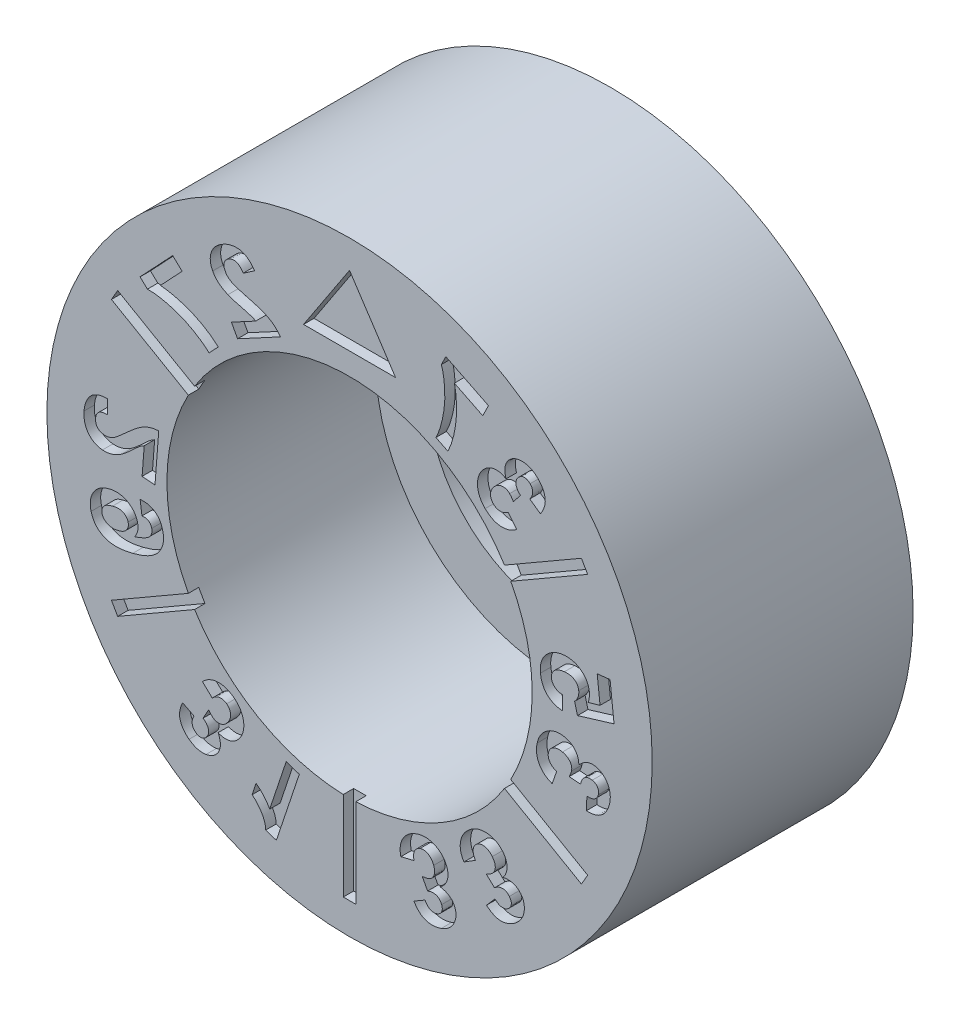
SolidWorks part; units mm, degrees
ref_plane "Front Plane" through (0, 0, 0) normal (0, 0, 1) x (1, 0, 0)
ref_plane "Top Plane" through (0, 0, 0) normal (0, 1, 0) x (1, 0, 0)
ref_plane "Right Plane" through (0, 0, 0) normal (1, 0, 0) x (0, 0, -1)
imported_body "Imported1"
other "Move Face2" parameters "D1"=0.157
other "DeleteFace1"
sketch "Sketch1" plane through (0, 0, 0) normal (0, 0, 1) x (1, 0, 0)
  line L0 (0, 0) -> (0, -3.3409) construction
  line L1 (0, 0) -> (-1.6705, -2.8933) construction
  line L3 (-0.06, -1.5) -> (0.06, -1.5)
  line L4 (-0.06, -1.5) -> (-0.06, -2.6)
  line L5 (-0.06, -2.6) -> (0.06, -2.6)
  line L6 (0.06, -1.5) -> (0.06, -2.6)
  line L11 (0, 0) -> (-2.8933, -1.6705) construction
  line L12 (-1.329, -0.698) -> (-1.269, -0.802)
  line L13 (-1.269, -0.802) -> (-2.2217, -1.352)
  line L14 (-1.329, -0.698) -> (-2.2817, -1.248)
  line L15 (-2.2817, -1.248) -> (-2.2217, -1.352)
  line L16 (0, 0) -> (-3.3409, 0) construction
  line L21 (0, 0) -> (-2.8933, 1.6705) construction
  line L22 (-1.269, 0.802) -> (-1.329, 0.698)
  line L23 (-1.329, 0.698) -> (-2.2817, 1.248)
  line L24 (-1.269, 0.802) -> (-2.2217, 1.352)
  line L25 (-2.2217, 1.352) -> (-2.2817, 1.248)
  line L26 (0, 0) -> (-1.6705, 2.8933) construction
  line L31 (0, 0) -> (0, 3.3409) construction
  line L36 (0, 0) -> (1.6705, 2.8933) construction
  line L41 (0, 0) -> (2.8933, 1.6705) construction
  line L42 (1.329, 0.698) -> (1.269, 0.802)
  line L43 (1.269, 0.802) -> (2.2217, 1.352)
  line L44 (1.329, 0.698) -> (2.2817, 1.248)
  line L45 (2.2817, 1.248) -> (2.2217, 1.352)
  line L46 (0, 0) -> (3.3409, 0) construction
  line L51 (0, 0) -> (2.8933, -1.6705) construction
  line L52 (1.269, -0.802) -> (1.329, -0.698)
  line L53 (1.329, -0.698) -> (2.2817, -1.248)
  line L54 (1.269, -0.802) -> (2.2217, -1.352)
  line L55 (2.2217, -1.352) -> (2.2817, -1.248)
  line L56 (0, 0) -> (1.6705, -2.8933) construction
  line L61 (0.06, 1.5) -> (0.06, 2.6)
  line L62 (-0.06, 1.5) -> (-0.06, 2.6)
  line L63 (0.06, 1.5) -> (-0.06, 1.5)
  line L64 (0.06, 2.6) -> (-0.06, 2.6)
  line L65 (0.802, 1.269) -> (1.352, 2.2217)
  line L66 (0.698, 1.329) -> (1.248, 2.2817)
  line L67 (1.352, 2.2217) -> (1.248, 2.2817)
  line L68 (0.802, 1.269) -> (0.698, 1.329)
  line L69 (-0.698, 1.329) -> (-1.248, 2.2817)
  line L70 (-1.248, 2.2817) -> (-1.352, 2.2217)
  line L71 (-0.802, 1.269) -> (-1.352, 2.2217)
  line L72 (-0.698, 1.329) -> (-0.802, 1.269)
  line L73 (1.5, 0.06) -> (2.6, 0.06)
  line L74 (1.5, -0.06) -> (2.6, -0.06)
  line L75 (1.5, -0.06) -> (1.5, 0.06)
  line L76 (2.6, -0.06) -> (2.6, 0.06)
  line L77 (-1.5, 0.06) -> (-2.6, 0.06)
  line L78 (-1.5, -0.06) -> (-2.6, -0.06)
  line L79 (-1.5, 0.06) -> (-1.5, -0.06)
  line L80 (-2.6, 0.06) -> (-2.6, -0.06)
  line L81 (0.802, -1.269) -> (1.352, -2.2217)
  line L82 (0.698, -1.329) -> (1.248, -2.2817)
  line L83 (-0.698, -1.329) -> (-1.248, -2.2817)
  line L84 (-0.802, -1.269) -> (-1.352, -2.2217)
  line L85 (-0.802, -1.269) -> (-0.698, -1.329)
  line L86 (0.698, -1.329) -> (0.802, -1.269)
  line L87 (1.248, -2.2817) -> (1.352, -2.2217)
  line L88 (-1.352, -2.2217) -> (-1.248, -2.2817)
  arc A0 (-0.6417, 1.7581) -> (0, 1.8715) centre (0, 0) ccw construction
  text T0 "27  29  31  33  35  37" font "Arial" height 0.7
  point P66 (0, 0)
  dimension "D1" = 3.743
  dimension "D6" = 12
extrude "Cut-Extrude1" cut sketch "Sketch1" against normal blind 0.1
other "Move Face3" parameters "D1"=0.5
sketch "Sketch2" plane through (0, 0, 0) normal (0, 1, 0) x (1, 0, 0)
  line L0 (2.9, 2.5) -> (-2.9, 2.5) construction
  line L1 (-1.8, 2.5) -> (-2.2, 2.5)
  arc A0 (-2.2, 2.5) -> (-1.8, 2.5) centre (-2, 2.5) cw
  dimension "D2" = 0.2
  dimension "D1" = 2
revolve "Revolve1" add sketch "Sketch2" angle 360 about L1
